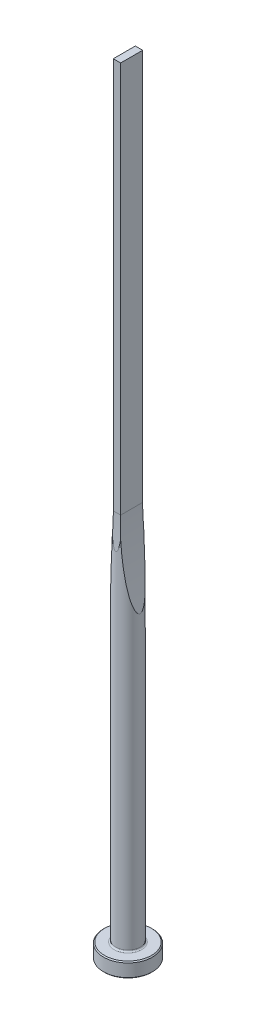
SolidWorks part; units mm, degrees
ref_plane "Front Plane" through (0, 0, 0) normal (0, 0, 1) x (1, 0, 0)
ref_plane "Top Plane" through (0, 0, 0) normal (0, 1, 0) x (1, 0, 0)
ref_plane "Right Plane" through (0, 0, 0) normal (1, 0, 0) x (0, 0, -1)
sketch "Sketch1" plane through (0, 0, 0) normal (0, 0, 1) x (1, 0, 0)
  line L0 (0, 0) -> (4.8, 0)
  line L1 (55, 0) -> (-55, 0) construction
  line L2 (5, 0.2) -> (5, 2.8)
  line L3 (4.8, 3) -> (2.8, 3)
  line L4 (2.5, 3.3) -> (2.5, 160)
  line L5 (0, 160) -> (2.5, 160)
  line L6 (5, 2.8) -> (4.8, 3)
  line L7 (4.8, 0) -> (5, 0.2)
  line L8 (0, 160) -> (0, 0)
  arc A0 (2.5, 3.3) -> (2.8, 3) centre (2.8, 3.3) ccw
  point P1 (5, 0)
  point P6 (5, 3)
  dimension "D4" = 0.3
  dimension "D1" = 2.5
  dimension "D2" = 5
  dimension "D3" = 3
  dimension "D5" = 160
revolve "Revolve1" add sketch "Sketch1" angle 360 about L8
sketch "Sketch2" plane through (0, 0, 0) normal (0, 0, 1) x (1, 0, 0)
  line L0 (0.75, 160) -> (0.75, 80)
  line L1 (2.5, 160) -> (-2.5, 160) construction
  line L2 (-0.75, 160) -> (-0.75, 80)
  line L3 (2.5, 160) -> (2.5, 62.3382)
  line L4 (-2.5, 160) -> (-2.5, 62.3382)
  line L5 (0, -5.5) -> (0, 5.5) construction
  line L6 (2.5, 160) -> (0.75, 160)
  line L8 (-0.75, 160) -> (-2.5, 160)
  arc A0 (0.75, 80) -> (2.5, 62.3382) centre (90.75, 80) ccw
  arc A1 (-0.75, 80) -> (-2.5, 62.3382) centre (-90.75, 80) cw
  dimension "D4" = 90
  dimension "D1" = 80
  dimension "D2" = 1.5
  dimension "D3" = 0.75
extrude "Cut-Extrude1" cut sketch "Sketch2" against normal mid plane 10
sketch "Sketch3" plane through (0, 0, 0) normal (1, 0, 0) x (0, 0, -1)
  line L0 (2.25, 160) -> (2.25, 80)
  line L1 (-2.3848, 160) -> (2.3848, 160) construction
  line L2 (-2.25, 160) -> (-2.25, 80)
  line L3 (2.5, 160) -> (2.5, 73.2965)
  line L4 (2.25, 160) -> (2.5, 160)
  line L5 (0, 5.5) -> (0, -5.5) construction
  line L6 (-2.5, 160) -> (-2.5, 73.2965)
  line L8 (-2.25, 160) -> (-2.5, 160)
  arc A0 (2.25, 80) -> (2.5, 73.2965) centre (92.25, 80) ccw
  arc A1 (-2.25, 80) -> (-2.5, 73.2965) centre (-92.25, 80) cw
  dimension "D2" = 90
  dimension "D1" = 80
  dimension "D3" = 4.5
  dimension "D4" = 2.25
extrude "Cut-Extrude2" cut sketch "Sketch3" against normal mid plane 10
